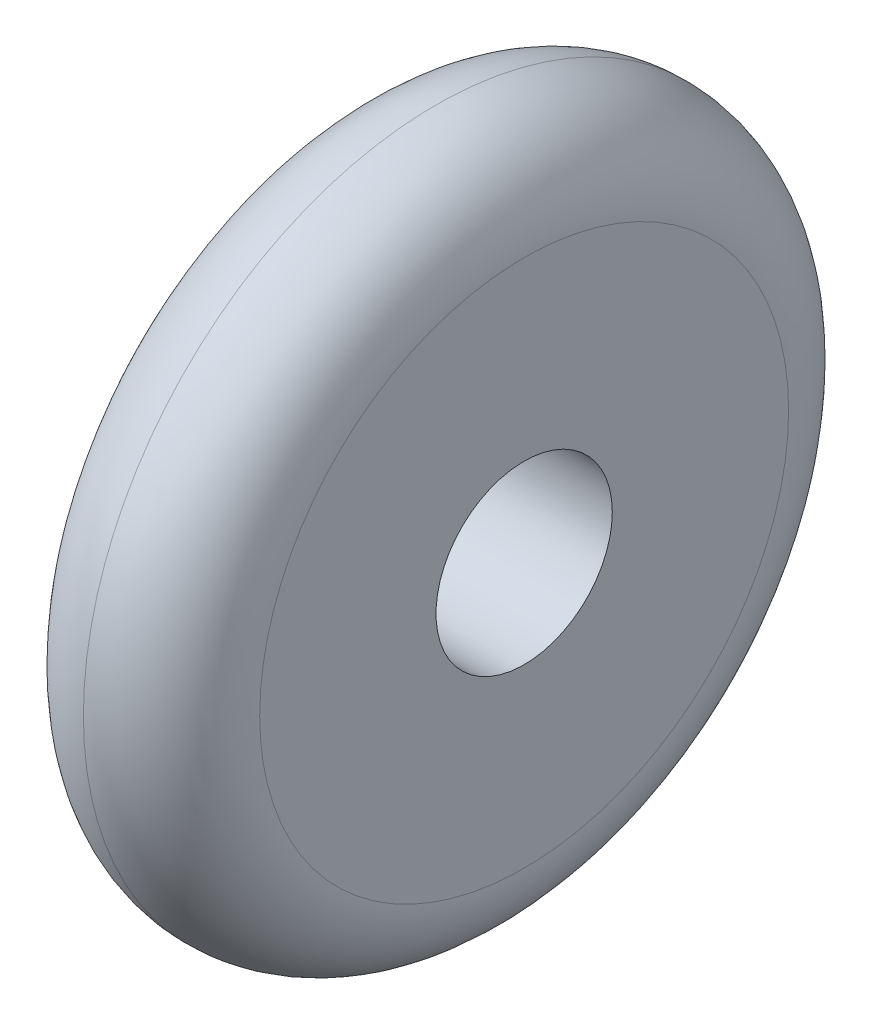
SolidWorks part; units mm, degrees
ref_plane "Front Plane" through (0, 0, 0) normal (0, 0, 1) x (1, 0, 0)
ref_plane "Top Plane" through (0, 0, 0) normal (0, 1, 0) x (1, 0, 0)
ref_plane "Right Plane" through (0, 0, 0) normal (1, 0, 0) x (0, 0, -1)
sketch "Sketch1" plane through (0, 0, 0) normal (1, 0, 0) x (0, 0, -1)
  circle A0 centre (0, 0) radius 25.4
  circle A1 centre (0, 0) radius 6.35
  dimension "D1" = 12.7
  dimension "D2" = 50.8
extrude "Boss-Extrude1" add sketch "Sketch1" along normal mid plane 12.7
fillet "Fillet1" radius 6.35 2 edges at (-6.35, 0, -25.4) (6.35, 0, -25.4)
